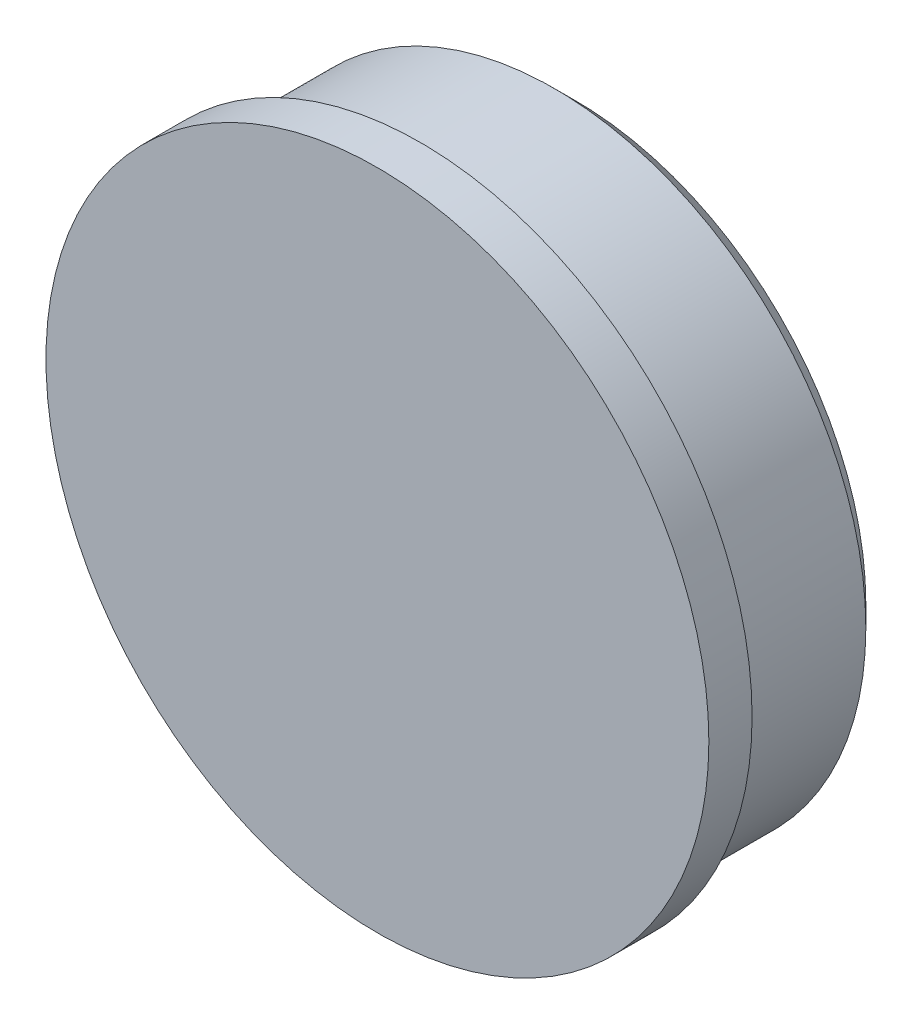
SolidWorks part; units mm, degrees
ref_plane "Спереди" through (0, 0, 0) normal (0, 0, 1) x (1, 0, 0)
ref_plane "Сверху" through (0, 0, 0) normal (0, 1, 0) x (1, 0, 0)
ref_plane "Справа" through (0, 0, 0) normal (1, 0, 0) x (0, 0, -1)
sketch "Эскиз1" plane through (0, 0, 0) normal (1, 0, 0) x (0, 0, -1)
  line L0 (0, 0) -> (28.0355, 0) construction
  line L1 (0, 0) -> (0, 12.6365)
  line L2 (0, 12.6365) -> (1.6478, 12.6365)
  line L3 (1.6478, 12.6365) -> (1.6478, 11.8745)
  line L4 (1.6478, 11.8745) -> (6.7469, 11.8745)
  line L5 (7.5406, 11.0808) -> (7.5406, 0)
  line L6 (7.5406, 0) -> (0, 0)
  line L7 (6.7469, 11.8745) -> (7.5406, 11.0808)
  point P7 (7.5406, 11.8745)
  dimension "D1" = 7.5406
  dimension "D2" = 5.8928
  dimension "D3" = 25.273
  dimension "D4" = 23.749
revolve "Повернуть1" add sketch "Эскиз1" angle 360 about L0
